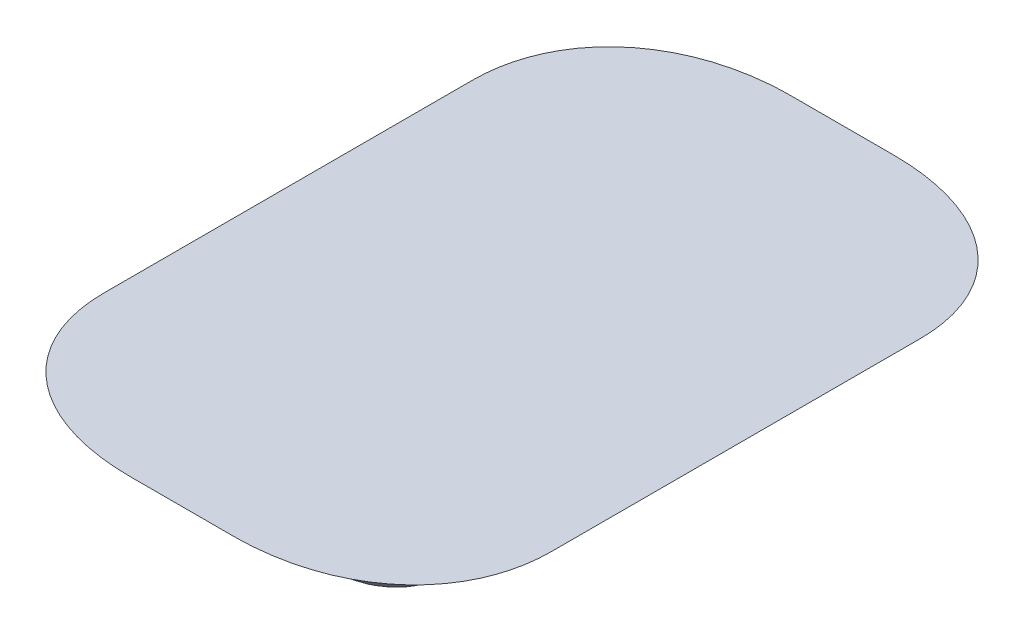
SolidWorks part; units mm, degrees
ref_plane "Plane1" through (0, 0, 0) normal (0, 0, 1) x (1, 0, 0)
ref_plane "Plane2" through (0, 0, 0) normal (0, 1, 0) x (1, 0, 0)
ref_plane "Plane3" through (0, 0, 0) normal (1, 0, 0) x (0, 0, -1)
sketch "Sketch1" plane through (0, 0, 0) normal (0, 0, 1) x (1, 0, 0)
  line L0 (-25, 1) -> (25, 1)
  line L1 (-25, 1) -> (-25, 0)
  line L2 (25, 0) -> (-25, 0)
  line L3 (25, 0) -> (25, 1)
  line L4 (0, 1) -> (0, 0) construction
  line L5 (50, 0) -> (-50, 0) construction
  dimension "D1" = 50
  dimension "D2" = 1
extrude "Base-Extrude" add sketch "Sketch1" along normal mid plane 50
sketch "Sketch2" plane through (0, 0, 0) normal (0, 0, 1) x (1, 0, 0)
  line L0 (0, 0) -> (0, -11.1464) construction
  line L1 (-10, 0) -> (-4.9654, -6)
  line L2 (25, 0) -> (-25, 0) construction
  line L3 (-4.9654, -6) -> (4.9654, -6)
  line L4 (-10, 0) -> (10, 0)
  line L5 (10, 0) -> (4.9654, -6)
  point P9 (0, 0)
  dimension "D1" = 20
  dimension "D2" = 50
  dimension "D3" = 6
extrude "Boss-Extrude1" add sketch "Sketch2" along normal mid plane 30
draft "Draft1" type of draft neutral plane draft angle 25 faces to draft 2 parameters "D1"=25
fillet "Fillet2" radius 5 12 edges at (0, 0, 15) (10, 0, 0) (-7.4827, -3, -13.6011) (-10, 0, 0) (0, -6, -12.2022) (-4.9654, -6, 0) (7.4827, -3, 13.6011) (4.9654, -6, 0) (-7.4827, -3, 13.6011) (0, -6, 12.2022) (0, 0, -15) (7.4827, -3, -13.6011)
sketch "Sketch3" plane through (25, 0, 0) normal (1, 0, 0) x (0, 0, -1)
  line L4 (25, 1) -> (-25, 1)
  line L5 (-25, 1) -> (-25, 0)
  line L6 (-25, 0) -> (25, 0)
  line L7 (25, 0) -> (25, 1)
  line L8 (25, 1) -> (-25, 1)
  line L9 (-25, 1) -> (-25, 0)
  line L10 (-25, 0) -> (25, 0)
  line L11 (25, 0) -> (25, 1)
  dimension "D1" = 0
extrude "Cut-Extrude1" cut sketch "Sketch3" against normal through all
sketch "Orientation sketch" plane through (0, 0, 0) normal (0, 1, 0) x (-1, 0, 0)
  line L4 (12.3315, -10.1489) -> (12.3315, 10.1489)
  line L5 (2.8237, 18.1854) -> (-2.8237, 18.1854)
  line L6 (-12.3315, 10.1489) -> (-12.3315, -10.1489)
  line L7 (-2.8237, -18.1854) -> (2.8237, -18.1854)
  line L8 (12.3315, -10.1489) -> (12.3315, 10.1489)
  line L9 (2.8237, 18.1854) -> (-2.8237, 18.1854)
  line L10 (-12.3315, 10.1489) -> (-12.3315, -10.1489)
  line L11 (-2.8237, -18.1854) -> (2.8237, -18.1854)
  ellipse E4 centre (-0.7225, -7.1516) end of major axis (11.3941, -13.8851) minor radius 10 (2.8237, -18.1854) -> (12.3315, -10.1489) ccw
  ellipse E5 centre (-0.7225, 7.1516) end of major axis (11.3941, 13.8851) minor radius 10 (12.3315, 10.1489) -> (2.8237, 18.1854) ccw
  ellipse E6 centre (0.7225, 7.1516) end of major axis (12.8392, 0.4181) minor radius 10 (-2.8237, 18.1854) -> (-12.3315, 10.1489) ccw
  ellipse E7 centre (0.7225, -7.1516) end of major axis (12.8392, -0.4181) minor radius 10 (-12.3315, -10.1489) -> (-2.8237, -18.1854) ccw
  ellipse E8 centre (-0.7225, -7.1516) end of major axis (11.3941, -13.8851) minor radius 10 (2.8237, -18.1854) -> (12.3315, -10.1489) ccw
  ellipse E9 centre (-0.7225, 7.1516) end of major axis (11.3941, 13.8851) minor radius 10 (12.3315, 10.1489) -> (2.8237, 18.1854) ccw
  ellipse E10 centre (0.7225, 7.1516) end of major axis (12.8392, 0.4181) minor radius 10 (-2.8237, 18.1854) -> (-12.3315, 10.1489) ccw
  ellipse E11 centre (0.7225, -7.1516) end of major axis (12.8392, -0.4181) minor radius 10 (-12.3315, -10.1489) -> (-2.8237, -18.1854) ccw
  dimension "D1" = 0
